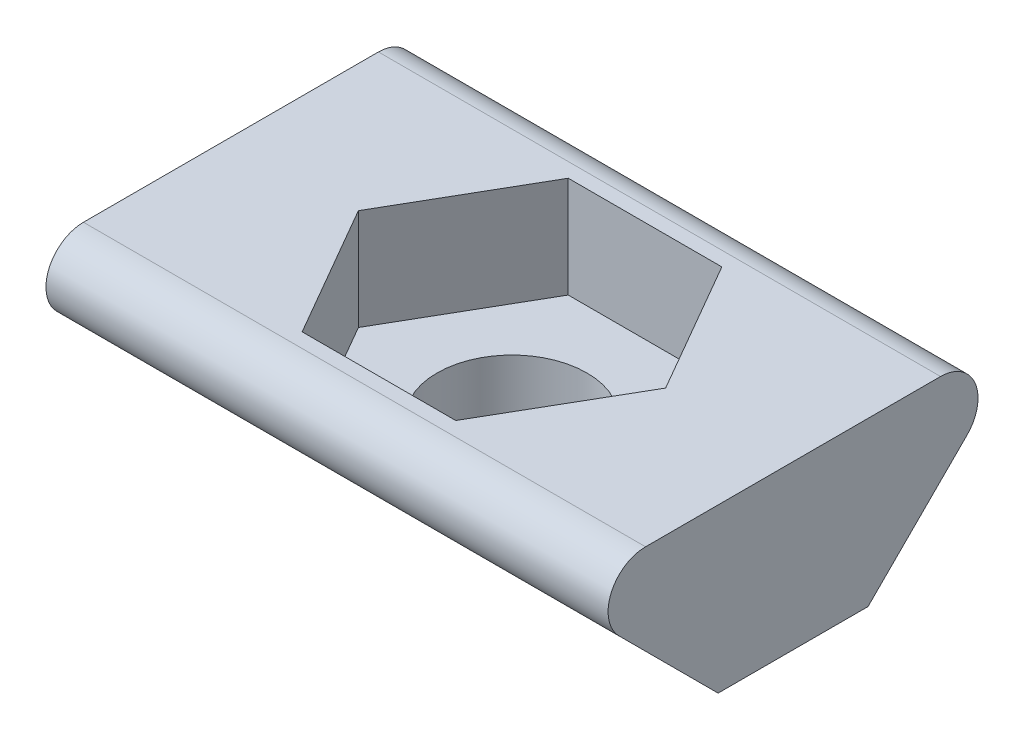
SolidWorks part; units mm, degrees
ref_plane "Alzado" through (0, 0, 0) normal (0, 0, 1) x (1, 0, 0)
ref_plane "Planta" through (0, 0, 0) normal (0, 1, 0) x (1, 0, 0)
ref_plane "Vista lateral" through (0, 0, 0) normal (1, 0, 0) x (0, 0, -1)
sketch "Sketch2" plane through (0, 0, 0) normal (1, 0, 0) x (0, 0, -1)
  line L0 (-3.9358, 4.35) -> (3.9358, 4.35)
  line L1 (4.6429, 2.6429) -> (2, 0)
  line L2 (2, 0) -> (-2, 0)
  line L3 (-2, 0) -> (-4.6429, 2.6429)
  line L4 (0, 0) -> (0, 9.3752) construction
  arc A0 (-3.9358, 4.35) -> (-4.6429, 2.6429) centre (-3.9358, 3.35) ccw
  arc A1 (3.9358, 4.35) -> (4.6429, 2.6429) centre (3.9358, 3.35) cw
  point P9 (-6.35, 4.35)
  point P12 (6.35, 4.35)
  dimension "D7" = 1
  dimension "D8" = 1
  dimension "D1" = 12.7
  dimension "D2" = 6.35
  dimension "D3" = 4
  dimension "D4" = 2
  dimension "D5" = 45
  dimension "D6" = 4.35
extrude "Boss-Extrude1" add sketch "Sketch2" along normal blind 15
sketch "Sketch3" plane through (0, 4.35, 0) normal (0, 1, 0) x (1, 0, 0)
  line L0 (7.5, 6.35) -> (7.5, -6.35) construction
  line L1 (15, 6.35) -> (0, 6.35) construction
  line L2 (15, -6.35) -> (0, -6.35) construction
  line L3 (7.5, -6.35) -> (15, 0) construction
  line L4 (15, 3.9358) -> (15, -3.9358) construction
  line L5 (15, 0) -> (0, 0) construction
  line L7 (11.5992, 0) -> (9.5496, 3.55)
  line L8 (9.5496, 3.55) -> (5.4504, 3.55)
  line L9 (5.4504, 3.55) -> (3.4008, 0)
  line L10 (3.4008, 0) -> (5.4504, -3.55)
  line L11 (5.4504, -3.55) -> (9.5496, -3.55)
  line L12 (9.5496, -3.55) -> (11.5992, 0)
  circle A0 centre (7.5, 0) radius 3.55 construction
  dimension "D1" = 7.1
extrude "Cut-Extrude1" cut sketch "Sketch3" against normal blind 2.7
sketch "Sketch4" plane through (0, 1.65, 0) normal (0, 1, 0) x (1, 0, 0)
  line L0 (0, 0) -> (15, 0) construction
  line L1 (15, 3.9358) -> (15, -3.9358) construction
  circle A0 centre (7.5, 0) radius 2
  dimension "D1" = 4
extrude "Cut-Extrude2" cut sketch "Sketch4" against normal blind 15
